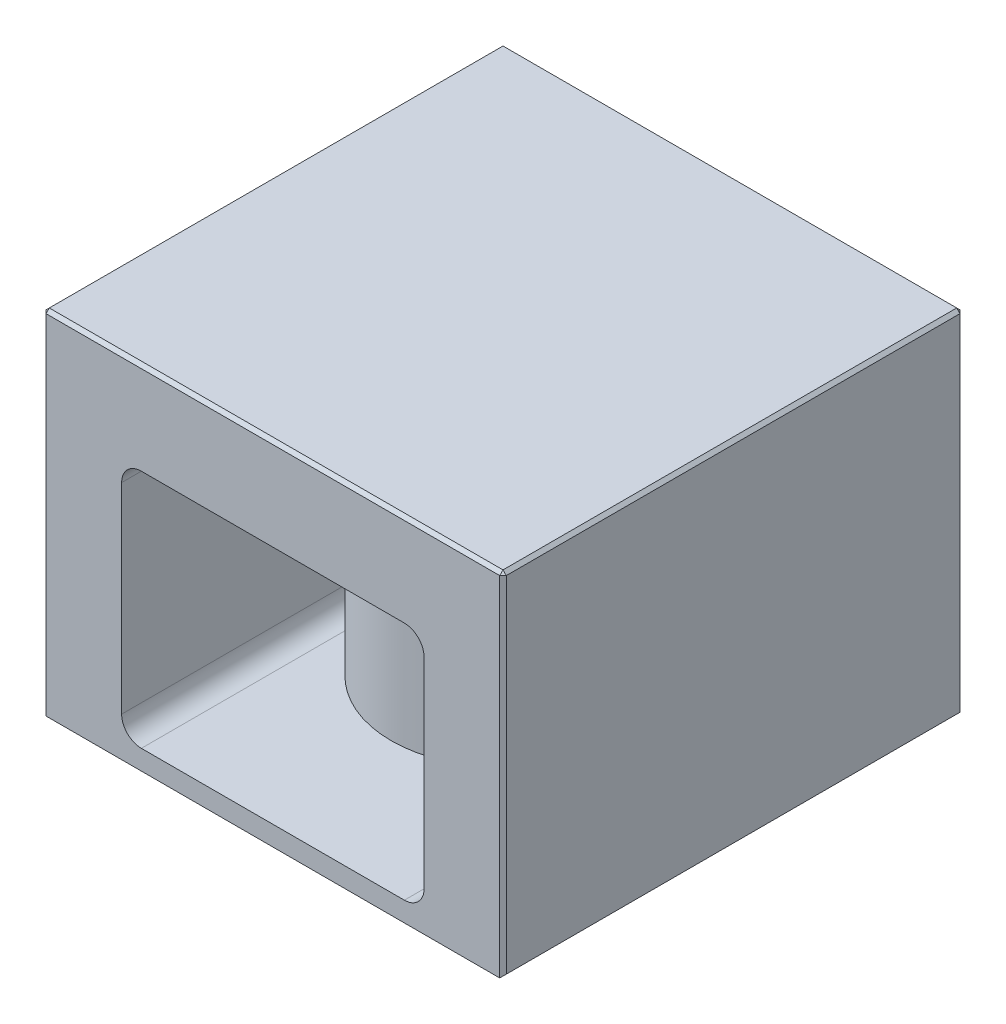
SolidWorks part; units mm, degrees
ref_plane "前视基准面" through (0, 0, 0) normal (0, 0, 1) x (1, 0, 0)
ref_plane "上视基准面" through (0, 0, 0) normal (0, 1, 0) x (1, 0, 0)
ref_plane "右视基准面" through (0, 0, 0) normal (1, 0, 0) x (0, 0, -1)
sketch "草图1" plane through (0, 0, 0) normal (0, 1, 0) x (1, 0, 0)
  line L1 (-35, -35) -> (35, -35)
  line L2 (-35, -35) -> (-35, 35)
  line L3 (-35, 35) -> (35, 35)
  line L4 (35, -35) -> (35, 35)
  line L5 (-35, -35) -> (35, 35) construction
  line L6 (-35, 35) -> (35, -35) construction
  point P0 (0, 0)
  dimension "D1" = 70
  dimension "D2" = 70
extrude "凸台-拉伸1" add sketch "草图1" against normal blind 53.5
sketch "草图2" plane through (0, 0, 35) normal (0, 0, 1) x (1, 0, 0)
  line L0 (-35, 0) -> (35, 0) construction
  line L1 (-20, -50.5) -> (20, -50.5)
  line L2 (-23, -47.5) -> (-23, -17)
  line L3 (-20, -14) -> (20, -14)
  line L4 (23, -47.5) -> (23, -17)
  line L5 (-23, -50.5) -> (23, -14) construction
  line L6 (-23, -14) -> (23, -50.5) construction
  line L7 (-35, -53.5) -> (-35, 0) construction
  arc A0 (20, -14) -> (23, -17) centre (20, -17) cw
  arc A1 (20, -50.5) -> (23, -47.5) centre (20, -47.5) ccw
  arc A2 (-20, -50.5) -> (-23, -47.5) centre (-20, -47.5) cw
  arc A3 (-23, -17) -> (-20, -14) centre (-20, -17) cw
  point P0 (0, -32.25)
  point P7 (0, 0)
  point P14 (0, 0)
  point P15 (0, 0)
  dimension "D4" = 3
  dimension "D5" = 3
  dimension "D1" = 14
  dimension "D2" = 36.5
  dimension "D3" = 12
extrude "切除-拉伸1" cut sketch "草图2" against normal up to surface (70 mm away)
chamfer "倒角1" distance 0.5 angle 45 10 edges at (35, -26.75, -35) (35, -53.5, 0) (35, -26.75, 35) (-35, -26.75, 35) (-35, -53.5, 0) (-35, -26.75, -35) (0, 0, 35) (-35, 0, 0) (0, 0, -35) (35, 0, 0)
sketch "草图3" plane through (0, -14, 0) normal (0, -1, 0) x (1, 0, 0)
  circle A0 centre (0, 0) radius 17
  dimension "D1" = 34
extrude "凸台-拉伸2" add sketch "草图3" along normal offset from surface (33 mm away) 2 from offset 1.5 separate body
